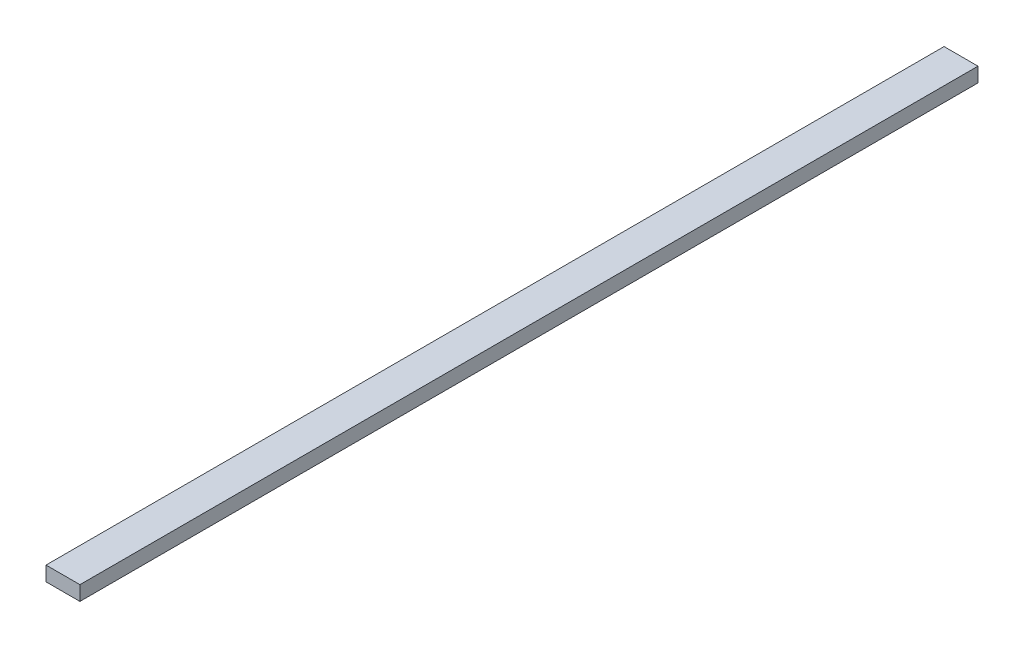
SolidWorks part; units mm, degrees
ref_plane "Front Plane" through (0, 0, 0) normal (0, 0, 1) x (1, 0, 0)
ref_plane "Top Plane" through (0, 0, 0) normal (0, 1, 0) x (1, 0, 0)
ref_plane "Right Plane" through (0, 0, 0) normal (1, 0, 0) x (0, 0, -1)
sketch "Sketch1" plane through (0, 0, 0) normal (0, 1, 0) x (1, 0, 0)
  line L0 (0, 0) -> (0, -2352.675)
  line L1 (0, -2352.675) -> (-88.9, -2352.675)
  line L2 (-88.9, -2352.675) -> (-88.9, 0)
  line L3 (-88.9, 0) -> (0, 0)
  dimension "D1" = 2352.675
  dimension "D3" = 88.9
extrude "Boss-Extrude1" add sketch "Sketch1" along normal blind 38.1
